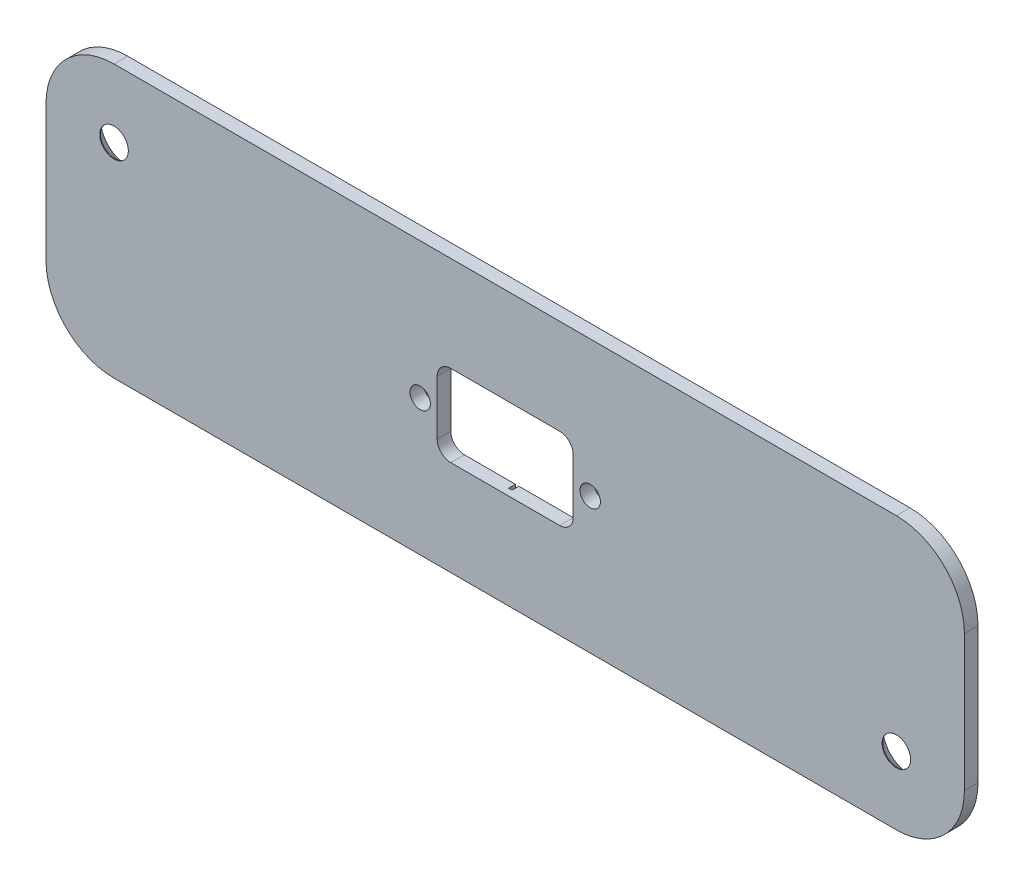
SolidWorks part; units mm, degrees
ref_plane "Plan de face" through (0, 0, 0) normal (0, 0, 1) x (1, 0, 0)
ref_plane "Plan de dessus" through (0, 0, 0) normal (0, 1, 0) x (1, 0, 0)
ref_plane "Plan de droite" through (0, 0, 0) normal (1, 0, 0) x (0, 0, -1)
sketch "Esquisse1" plane through (0, 0, 0) normal (0, 0, 1) x (1, 0, 0)
  line L1 (0, 0) -> (135, 0)
  line L2 (0, 0) -> (0, 40)
  line L3 (0, 40) -> (135, 40)
  line L4 (135, 0) -> (135, 40)
  dimension "D1" = 135
  dimension "D2" = 40
extrude "Boss.-Extru.1" add sketch "Esquisse1" along normal blind 2
sketch "Esquisse2" plane through (0, 0, 2) normal (0, 0, 1) x (1, 0, 0)
  line L0 (135, 40) -> (0, 40) construction
  line L1 (0, 40) -> (0, 0) construction
  line L2 (135, 0) -> (135, 40) construction
  line L3 (0, 0) -> (135, 0) construction
  circle A0 centre (10, 30) radius 2.1
  circle A2 centre (125, 10) radius 2.1
  dimension "D1" = 4.2
  dimension "D3" = 4.2
  dimension "D7" = 10
  dimension "D5" = 10
  dimension "D6" = 10
  dimension "D8" = 10
extrude "Enlèv. mat.-Extru.1" cut sketch "Esquisse2" against normal blind 2
chamfer "Chanfrein1" distance 1.9 angle 45 2 edges at (12.1, 30, 0) (127.1, 10, 0)
sketch "Esquisse3" plane through (0, 0, 0) normal (0, 0, -1) x (-1, 0, 0)
  line L0 (-135, 40) -> (0, 40) construction
  line L1 (-77.5, 26) -> (-57.5, 26)
  line L2 (-77.5, 26) -> (-77.5, 14)
  line L3 (-77.5, 14) -> (-57.5, 14)
  line L4 (-57.5, 26) -> (-57.5, 14)
  line L6 (-135, 0) -> (-135, 40) construction
  circle A0 centre (-80, 20) radius 1.5
  circle A1 centre (-55, 20) radius 1.5
  dimension "D1" = 3
  dimension "D2" = 3
  dimension "D3" = 20
  dimension "D4" = 25
  dimension "D5" = 2.5
  dimension "D6" = 12
  dimension "D7" = 6
  dimension "D8" = 14
  dimension "D9" = 57.5
  dimension "D11" = 6
extrude "Enlèv. mat.-Extru.2" cut sketch "Esquisse3" against normal through all
fillet "Congé2" radius 2 4 edges at (57.5, 14, 1) (57.5, 26, 1) (77.5, 26, 1) (77.5, 14, 1)
fillet "Congé3" radius 10 4 edges at (135, 0, 1) (0, 0, 1) (0, 40, 1) (135, 40, 1)
sketch "Esquisse4" plane through (0, 0, 0) normal (0, 0, -1) x (-1, 0, 0)
  line L0 (-75.5, 14) -> (-59.5, 14) construction
  line L1 (-67.5, 14) -> (-67, 14)
  line L2 (-67.5, 14) -> (-67.5, 4)
  line L3 (-67.5, 4) -> (-67, 4)
  line L4 (-67, 14) -> (-67, 4)
  line L5 (-77.5, 24) -> (-77.5, 16) construction
  text T0 "33 VC  "
  text T1 "34 VC"
  dimension "D1" = 0.5
  dimension "D2" = 10
  dimension "D3" = 10
extrude "Enlèv. mat.-Extru.3" cut sketch "Esquisse4" against normal blind 1
